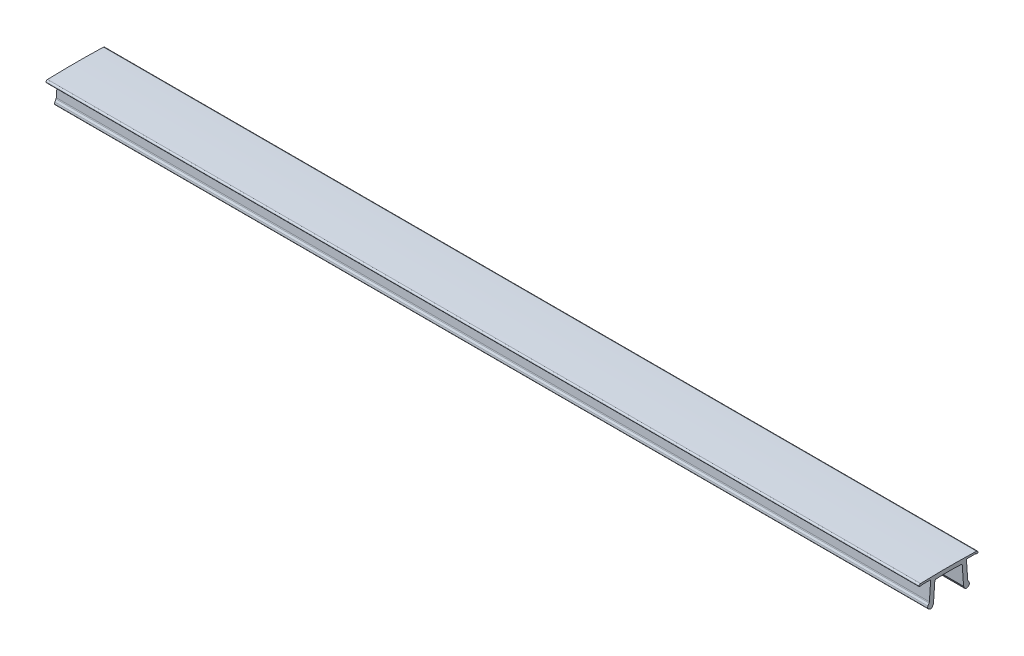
SolidWorks part; units mm, degrees
ref_plane "Front Plane" through (0, 0, 0) normal (0, 0, 1) x (1, 0, 0)
ref_plane "Top Plane" through (0, 0, 0) normal (0, 1, 0) x (1, 0, 0)
ref_plane "Right Plane" through (0, 0, 0) normal (1, 0, 0) x (0, 0, -1)
sketch3d "3DSketch1"
  line L0 (0, 0, 0) -> (200, 0, 0)
  dimension "D1" = 200
other "Peitelistat 1.6003 PEITELISTA GL HARMAA(1)"
ref_plane "Plane1" through (0, 0, 0) normal (1, 0, 0) x (0, 0, -1)
sketch "Sketch1" plane through (0, 0, 0) normal (1, 0, 0) x (0, 0, -1)
  line L0 (-6.3567, 2.7681) -> (-6.3567, 2.7207)
  line L1 (-6.2567, 2.6207) -> (-5.9567, 2.6207)
  line L2 (-5.7835, 2.7207) -> (-3.8069, 2.7207)
  line L3 (-3.7072, 2.6138) -> (-3.9962, -1.5199)
  line L4 (-4.062, -1.7351) -> (-4.3282, -2.1961)
  line L5 (-4.1065, -2.8992) -> (-3.7584, -3.0615)
  line L6 (-3.3718, -2.9396) -> (-3.0893, -2.4503)
  line L7 (-3.0498, -2.3212) -> (-2.7504, 1.9602)
  line L8 (3.5371, 1.9602) -> (3.8364, -2.3212)
  line L9 (3.8759, -2.4503) -> (4.1585, -2.9396)
  line L10 (4.545, -3.0615) -> (4.8931, -2.8992)
  line L11 (5.1148, -2.1961) -> (4.8486, -1.7351)
  line L12 (4.7829, -1.5199) -> (4.4938, 2.6138)
  line L13 (4.5936, 2.7207) -> (6.5701, 2.7207)
  line L14 (6.7433, 2.6207) -> (7.0433, 2.6207)
  line L15 (7.1433, 2.7207) -> (7.1433, 2.7681)
  arc A0 (-6.0179, 3.118) -> (-6.3567, 2.7681) centre (-6.0067, 2.7681) ccw
  arc A1 (-6.3567, 2.7207) -> (-6.2567, 2.6207) centre (-6.2567, 2.7207) ccw
  arc A2 (-5.9567, 2.6207) -> (-5.8701, 2.6707) centre (-5.9567, 2.7207) ccw
  arc A3 (-5.7835, 2.7207) -> (-5.8701, 2.6707) centre (-5.7835, 2.6207) ccw
  arc A4 (-3.7072, 2.6138) -> (-3.8069, 2.7207) centre (-3.8069, 2.6207) ccw
  arc A5 (-4.062, -1.7351) -> (-3.9962, -1.5199) centre (-4.495, -1.4851) ccw
  arc A6 (-4.3282, -2.1961) -> (-4.1065, -2.8992) centre (-3.8952, -2.4461) ccw
  arc A7 (-3.7584, -3.0615) -> (-3.3718, -2.9396) centre (-3.6316, -2.7896) ccw
  arc A8 (-3.0893, -2.4503) -> (-3.0498, -2.3212) centre (-3.3491, -2.3003) ccw
  arc A9 (-2.4683, 2.2388) -> (-2.7504, 1.9602) centre (-2.4512, 1.9393) ccw
  arc A10 (3.255, 2.2388) -> (-2.4683, 2.2388) centre (0.3933, -47.6793) ccw
  arc A11 (3.5371, 1.9602) -> (3.255, 2.2388) centre (3.2378, 1.9393) ccw
  arc A12 (3.8364, -2.3212) -> (3.8759, -2.4503) centre (4.1357, -2.3003) ccw
  arc A13 (4.1585, -2.9396) -> (4.545, -3.0615) centre (4.4183, -2.7896) ccw
  arc A14 (4.8931, -2.8992) -> (5.1148, -2.1961) centre (4.6818, -2.4461) ccw
  arc A15 (4.7829, -1.5199) -> (4.8486, -1.7351) centre (5.2816, -1.4851) ccw
  arc A16 (4.5936, 2.7207) -> (4.4938, 2.6138) centre (4.5936, 2.6207) ccw
  arc A17 (6.6567, 2.6707) -> (6.5701, 2.7207) centre (6.5701, 2.6207) ccw
  arc A18 (6.6567, 2.6707) -> (6.7433, 2.6207) centre (6.7433, 2.7207) ccw
  arc A19 (7.0433, 2.6207) -> (7.1433, 2.7207) centre (7.0433, 2.7207) ccw
  arc A20 (7.1433, 2.7681) -> (6.8045, 3.118) centre (6.7933, 2.7681) ccw
  arc A21 (6.8045, 3.118) -> (-6.0179, 3.118) centre (0.3933, -196.7792) ccw
  point P60 (0, 0)
